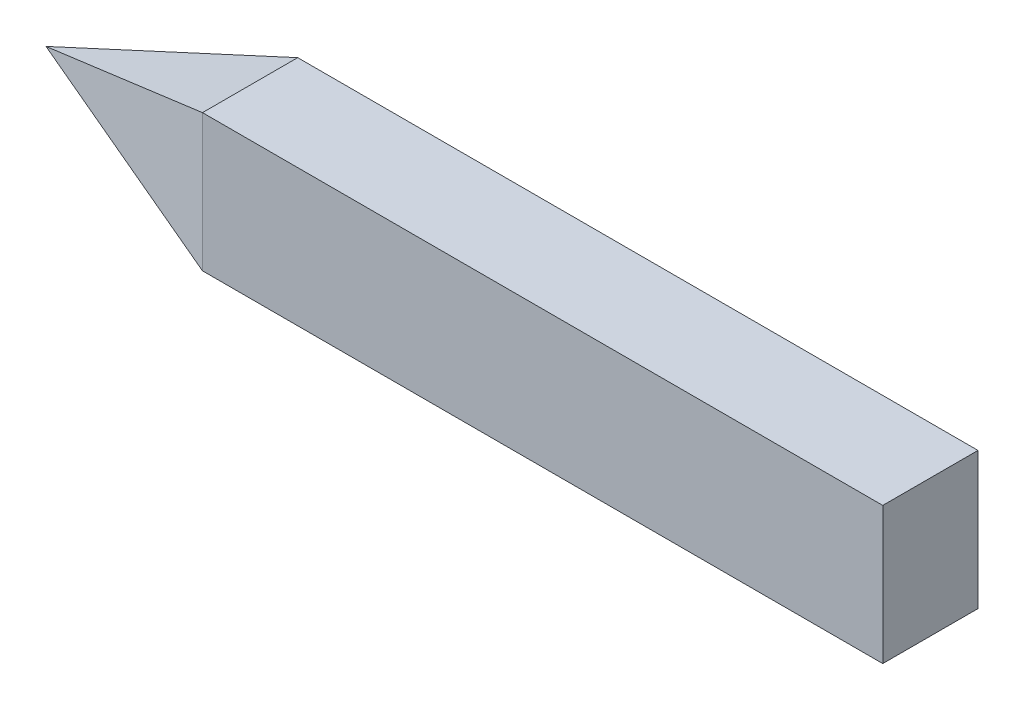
SolidWorks part; units mm, degrees
ref_plane "Front" through (0, 0, 0) normal (0, 0, 1) x (1, 0, 0)
ref_plane "Top" through (0, 0, 0) normal (0, 1, 0) x (1, 0, 0)
ref_plane "Right" through (0, 0, 0) normal (1, 0, 0) x (0, 0, -1)
sketch "Sketch1" plane through (0, 0, 0) normal (0, 0, 1) x (1, 0, 0)
  line L0 (75, 25.1732) -> (0, 0)
  line L1 (75, 25.1732) -> (325, 25.1732)
  line L2 (0, 0) -> (75, -25.1732)
  line L3 (75, -25.1732) -> (325, -25.1732)
  line L4 (325, 25.1732) -> (325, -25.1732)
  line L5 (-61.7064, 0) -> (486.5983, 0) construction
  dimension "D1" = 50.3465
  dimension "D2" = 325
  dimension "D3" = 250
extrude "Extrude1" add sketch "Sketch1" along normal mid plane 35
sketch "Sketch3" plane through (0, 0, 0) normal (0, 0, 1) x (1, 0, 0)
  line L0 (75, 25.1732) -> (75, -25.1732)
ref_plane "Plane1" through (0, 0, 0) normal (-0.2272, 0, -0.9738) x (-0.9738, 0, 0.2272)
split "Split1" trim tools "Plane1" resulting bodies 106
ref_plane "Plane2" through (0, 0, 0) normal (0.2272, 0, -0.9738) x (-0.9738, 0, -0.2272)
split "Split2" trim tools "Plane2" resulting bodies 108
